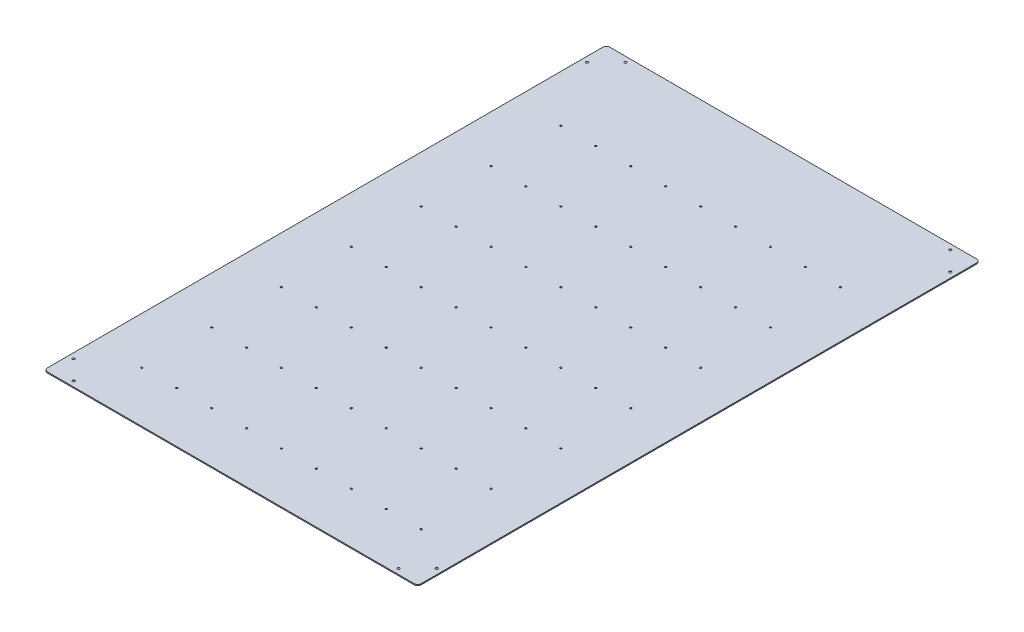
SolidWorks part; units mm, degrees
ref_plane "前视基准面" through (0, 0, 0) normal (0, 0, 1) x (1, 0, 0)
ref_plane "上视基准面" through (0, 0, 0) normal (0, 1, 0) x (1, 0, 0)
ref_plane "右视基准面" through (0, 0, 0) normal (1, 0, 0) x (0, 0, -1)
other "Configuration Table"
sketch "草图1" plane through (0, 0, 0) normal (0, 1, 0) x (1, 0, 0)
  line L1 (-535, 805) -> (535, 805)
  line L2 (-535, 805) -> (-535, -805)
  line L3 (-535, -805) -> (535, -805)
  line L4 (535, 805) -> (535, -805)
  line L5 (-535, 805) -> (535, -805) construction
  line L6 (-535, -805) -> (535, 805) construction
  point P0 (0, 0)
  point P6 (-465, -790)
  point P7 (465, 790)
  point P8 (465, -790)
  point P9 (-520, 735)
  point P10 (-520, -735)
  point P11 (520, -735)
  point P12 (-465, 790)
  point P13 (520, 735)
  point P14 (-400, -660)
  dimension "D15" = 70
  dimension "D1" = 15
  dimension "D2" = 70
  dimension "D3" = 70
  dimension "D4" = 15
  dimension "D5" = 70
  dimension "D6" = 15
  dimension "D7" = 70
  dimension "D8" = 15
  dimension "D9" = 15
  dimension "D10" = 70
  dimension "D11" = 15
  dimension "D12" = 15
  dimension "D13" = 145
  dimension "D14" = 135
  dimension "D16" = 70
  dimension "D17" = 70
  dimension "D18" = 15
extrude "凸台-拉伸1" add sketch "草图1" along normal blind 3
hole_wizard "M6 内六角花形半沉头螺钉的锥形沉头孔1" positions "草图4" profile "草图5" countersink size "M6" standard "GB"
sketch "草图4" plane through (0, 0, 0) normal (0, -1, 0) x (-1, 0, 0)
  point P0 (-465, 790)
  point P3 (-520, 735)
  point P6 (-520, -735)
  point P9 (-465, -790)
  point P12 (465, -790)
  point P15 (520, -735)
  point P18 (520, 735)
  point P21 (465, 790)
sketch "草图5" plane through (465, 0, -790) normal (1, 0, 0) x (0, 0, -1)
  line L0 (0, 0) -> (0, 3)
  line L1 (0, 3) -> (3.5, 3)
  line L2 (3.5, 3) -> (3.5, 2.9)
  line L3 (3.5, 2.9) -> (6.4, 0)
  line L5 (6.4, 0) -> (0, 0)
  line L6 (-3.5, 2.9) -> (-6.4, 0) construction
  line L11 (0, -6.35) -> (0, 107.95) construction
  dimension "通孔孔直径" = 7
  dimension "通孔孔深度" = 3
  dimension "近端锥形沉头孔直径" = 12.8
  dimension "近端锥形沉头孔角度" = 90
hole_wizard "M6 螺纹孔1" positions "草图6" profile "草图7" tap size "M6" standard "GB"
sketch "草图6" plane through (0, 3, 0) normal (0, 1, 0) x (1, 0, 0)
  point P0 (-400, -660)
sketch "草图7" plane through (-400, 3, 660) normal (1, 0, 0) x (0, 0, 1)
  line L0 (0, 0) -> (0, 3)
  line L1 (0, 3) -> (2.5, 3)
  line L2 (2.5, 3) -> (2.5, 0)
  line L5 (2.5, 0) -> (0, 0)
  line L11 (0, -6.35) -> (0, 107.95) construction
  dimension "通孔螺纹孔钻头直径" = 5
  dimension "通孔螺纹孔钻头深度" = 3
pattern_linear "阵列(线性)1" count 7 spacing 200 along (0, 0, -1) count 9 spacing 100 along (1, 0, 0) of "M6 螺纹孔1"
fillet "圆角1" radius 10 4 edges at (-535, 1.5, -805) (535, 1.5, -805) (-535, 1.5, 805) (535, 1.5, 805)
